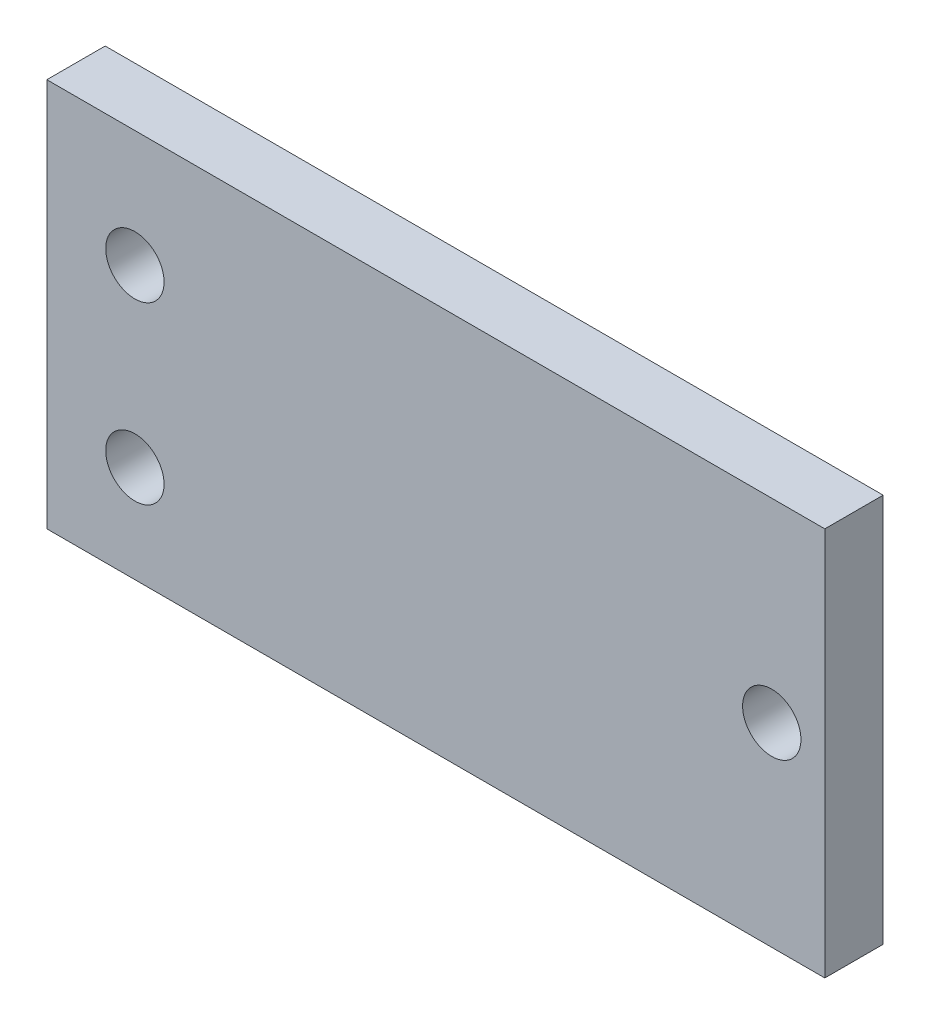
SolidWorks part; units mm, degrees
ref_plane "Front" through (0, 0, 0) normal (0, 0, 1) x (1, 0, 0)
ref_plane "Top" through (0, 0, 0) normal (0, 1, 0) x (1, 0, 0)
ref_plane "Right" through (0, 0, 0) normal (1, 0, 0) x (0, 0, -1)
sketch "Sketch1" plane through (0, 0, 0) normal (0, 0, 1) x (1, 0, 0)
  line L1 (0, 0) -> (40, 0)
  line L2 (0, 0) -> (0, -20)
  line L3 (0, -20) -> (40, -20)
  line L4 (40, 0) -> (40, -20)
  circle A0 centre (37.2725, -10) radius 1.5
  circle A1 centre (4.5269, -6) radius 1.5
  circle A2 centre (4.5269, -15) radius 1.5
  point P11 (37.2725, -10)
  point P12 (0, 0)
  dimension "D4" = 3
  dimension "D5" = 3
  dimension "D6" = 3
  dimension "D1" = 40
  dimension "D2" = 20
  dimension "D3" = 10
  dimension "D7" = 9
  dimension "D8" = 5
extrude "Boss-Extrude1" add sketch "Sketch1" along normal blind 3
